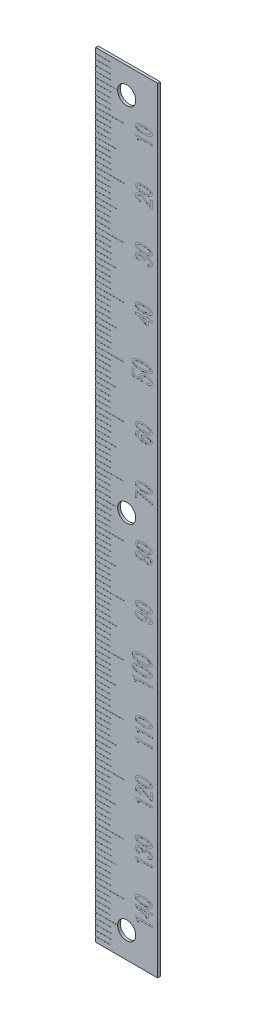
SolidWorks part; units mm, degrees
ref_plane "Front" through (0, 0, 0) normal (0, 0, 1) x (1, 0, 0)
ref_plane "Top" through (0, 0, 0) normal (0, 1, 0) x (1, 0, 0)
ref_plane "Right" through (0, 0, 0) normal (1, 0, 0) x (0, 0, -1)
sketch "Sketch1" plane through (0, 0, 0) normal (0, 0, 1) x (1, 0, 0)
  line L1 (0, 0) -> (0, 150)
  line L2 (0, 0) -> (12, 0)
  line L3 (12, 0) -> (12, 150)
  line L4 (0, 150) -> (12, 150)
  dimension "D1" = 150
  dimension "D2" = 12
extrude "Extrude1" add sketch "Sketch1" along normal blind 0.5
sketch "Sketch2" plane through (0, 0, 0.5) normal (0, 0, 1) x (1, 0, 0)
  line L0 (0, 150) -> (0, 0) construction
  line L1 (0, 0) -> (12, 0) construction
  line L2 (12, 150) -> (0, 150) construction
  circle A0 centre (6, 5) radius 1.75
  circle A1 centre (6, 145) radius 1.75
  circle A4 centre (6, 75) radius 1.75
  dimension "D1" = 6
  dimension "D2" = 6
  dimension "D3" = 5
  dimension "D4" = 5
  dimension "D5" = 3.5
  dimension "D6" = 3.5
  dimension "D8" = 2
extrude "Extrude2" cut sketch "Sketch2" against normal through all
sketch "Sketch3" plane through (0, 0, 0.5) normal (0, 0, 1) x (1, 0, 0)
  line L0 (12, 150) -> (0, 150) construction
  line L1 (7.5, 138.25) -> (11, 138.25) construction
  line L2 (7.5, 138.25) -> (7.5, 141.75) construction
  line L3 (7.5, 141.75) -> (11, 141.75) construction
  line L4 (11, 138.25) -> (11, 141.75) construction
  line L6 (11, 128.25) -> (11, 131.75) construction
  line L7 (11, 118.25) -> (11, 121.75) construction
  line L8 (11, 108.25) -> (11, 111.75) construction
  line L9 (11, 98.25) -> (11, 101.75) construction
  line L10 (11, 88.25) -> (11, 91.75) construction
  line L11 (11, 78.25) -> (11, 81.75) construction
  line L12 (11, 68.25) -> (11, 71.75) construction
  line L13 (11, 58.25) -> (11, 61.75) construction
  line L14 (11, 47.2) -> (11, 52.8) construction
  line L15 (11, 37.2) -> (11, 42.8) construction
  line L16 (11, 48.25) -> (11, 51.75) construction
  line L17 (11, 50) -> (-4.9003, 50) construction
  line L18 (11, 27.2) -> (11, 32.8) construction
  line L19 (11, 17.2) -> (11, 22.8) construction
  line L20 (11, 7.2) -> (11, 12.8) construction
  line L21 (12, 0) -> (12, 150) construction
  text T0 "10" font "ＭＳ ゴシック" height in points 11
  text T1 "20" font "ＭＳ ゴシック" height in points 11
  text T2 "30" font "ＭＳ ゴシック" height in points 11
  text T3 "40" font "ＭＳ ゴシック" height in points 11
  text T4 "50" font "ＭＳ ゴシック" height in points 13
  text T5 "60  " font "ＭＳ ゴシック" height in points 11
  text T6 "70" font "ＭＳ ゴシック" height in points 11
  text T7 "80" font "ＭＳ ゴシック" height in points 11
  text T8 "90" font "ＭＳ ゴシック" height in points 11
  text T9 "100" font "ＭＳ ゴシック" height in points 13
  text T10 "110" font "ＭＳ ゴシック" height in points 11
  text T11 "120" font "ＭＳ ゴシック" height in points 11
  text T12 "130" font "ＭＳ ゴシック" height in points 11
  text T13 "140" font "ＭＳ ゴシック" height in points 11
  point P4 (11, 140)
  dimension "D1" = 3.5
  dimension "D2" = 10
  dimension "D3" = 1
  dimension "D4" = 3.5
  dimension "D8" = 5.6
  dimension "D9" = 1
  dimension "D5" = 4
  dimension "D6" = 7
  dimension "D7" = 5
extrude "Extrude3" cut sketch "Sketch3" against normal blind 0.01
sketch "Sketch4" plane through (0, 0, 0.5) normal (0, 0, 1) x (1, 0, 0)
  line L608 (3, 1.05) -> (3, 0.95)
  line L609 (0, 0.95) -> (3, 0.95)
  line L610 (0, 1.05) -> (3, 1.05)
  line L611 (0, 1.05) -> (0, 0.95)
  line L612 (3, 2.05) -> (3, 1.95)
  line L613 (0, 1.95) -> (3, 1.95)
  line L614 (0, 2.05) -> (3, 2.05)
  line L615 (0, 2.05) -> (0, 1.95)
  line L616 (3, 3.05) -> (3, 2.95)
  line L617 (0, 2.95) -> (3, 2.95)
  line L618 (0, 3.05) -> (3, 3.05)
  line L619 (0, 3.05) -> (0, 2.95)
  line L620 (3, 4.05) -> (3, 3.95)
  line L621 (0, 3.95) -> (3, 3.95)
  line L622 (0, 4.05) -> (3, 4.05)
  line L623 (0, 4.05) -> (0, 3.95)
  line L624 (3, 6.05) -> (3, 5.95)
  line L625 (0, 5.95) -> (3, 5.95)
  line L626 (0, 6.05) -> (3, 6.05)
  line L627 (0, 6.05) -> (0, 5.95)
  line L628 (3, 7.05) -> (3, 6.95)
  line L629 (0, 6.95) -> (3, 6.95)
  line L630 (0, 7.05) -> (3, 7.05)
  line L631 (0, 7.05) -> (0, 6.95)
  line L632 (3, 8.05) -> (3, 7.95)
  line L633 (0, 7.95) -> (3, 7.95)
  line L634 (0, 8.05) -> (3, 8.05)
  line L635 (3, 9.05) -> (3, 8.95)
  line L636 (0, 8.95) -> (3, 8.95)
  line L637 (0, 9.05) -> (0, 8.95)
  line L638 (0, 9.05) -> (3, 9.05)
  line L639 (4, 4.95) -> (4, 5.05)
  line L640 (0, 5.05) -> (4, 5.05)
  line L641 (0, 4.95) -> (0, 5.05)
  line L642 (0, 4.95) -> (4, 4.95)
  line L643 (0, 8.05) -> (0, 7.95)
  line L644 (0, 9.95) -> (0, 10.05)
  line L645 (5.5, 9.95) -> (0, 9.95)
  line L646 (5.5, 10.05) -> (5.5, 9.95)
  line L647 (0, 10.05) -> (5.5, 10.05)
  line L648 (3, 11.05) -> (3, 10.95)
  line L649 (0, 10.95) -> (3, 10.95)
  line L650 (0, 11.05) -> (3, 11.05)
  line L651 (0, 11.05) -> (0, 10.95)
  line L652 (3, 12.05) -> (3, 11.95)
  line L653 (0, 11.95) -> (3, 11.95)
  line L654 (0, 12.05) -> (3, 12.05)
  line L655 (0, 12.05) -> (0, 11.95)
  line L656 (3, 13.05) -> (3, 12.95)
  line L657 (0, 12.95) -> (3, 12.95)
  line L658 (0, 13.05) -> (3, 13.05)
  line L659 (0, 13.05) -> (0, 12.95)
  line L660 (3, 14.05) -> (3, 13.95)
  line L661 (0, 13.95) -> (3, 13.95)
  line L662 (0, 14.05) -> (3, 14.05)
  line L663 (0, 14.05) -> (0, 13.95)
  line L664 (3, 16.05) -> (3, 15.95)
  line L665 (0, 15.95) -> (3, 15.95)
  line L666 (0, 16.05) -> (3, 16.05)
  line L667 (0, 16.05) -> (0, 15.95)
  line L668 (3, 17.05) -> (3, 16.95)
  line L669 (0, 16.95) -> (3, 16.95)
  line L670 (0, 17.05) -> (3, 17.05)
  line L671 (0, 17.05) -> (0, 16.95)
  line L672 (3, 18.05) -> (3, 17.95)
  line L673 (0, 17.95) -> (3, 17.95)
  line L674 (0, 18.05) -> (3, 18.05)
  line L675 (3, 19.05) -> (3, 18.95)
  line L676 (0, 18.95) -> (3, 18.95)
  line L677 (0, 19.05) -> (0, 18.95)
  line L678 (0, 19.05) -> (3, 19.05)
  line L679 (4, 14.95) -> (4, 15.05)
  line L680 (0, 15.05) -> (4, 15.05)
  line L681 (0, 14.95) -> (0, 15.05)
  line L682 (0, 14.95) -> (4, 14.95)
  line L683 (0, 18.05) -> (0, 17.95)
  line L684 (0, 19.95) -> (0, 20.05)
  line L685 (5.5, 19.95) -> (0, 19.95)
  line L686 (5.5, 20.05) -> (5.5, 19.95)
  line L687 (0, 20.05) -> (5.5, 20.05)
  line L688 (3, 21.05) -> (3, 20.95)
  line L689 (0, 20.95) -> (3, 20.95)
  line L690 (0, 21.05) -> (3, 21.05)
  line L691 (0, 21.05) -> (0, 20.95)
  line L692 (3, 22.05) -> (3, 21.95)
  line L693 (0, 21.95) -> (3, 21.95)
  line L694 (0, 22.05) -> (3, 22.05)
  line L695 (0, 22.05) -> (0, 21.95)
  line L696 (3, 23.05) -> (3, 22.95)
  line L697 (0, 22.95) -> (3, 22.95)
  line L698 (0, 23.05) -> (3, 23.05)
  line L699 (0, 23.05) -> (0, 22.95)
  line L700 (3, 24.05) -> (3, 23.95)
  line L701 (0, 23.95) -> (3, 23.95)
  line L702 (0, 24.05) -> (3, 24.05)
  line L703 (0, 24.05) -> (0, 23.95)
  line L704 (3, 26.05) -> (3, 25.95)
  line L705 (0, 25.95) -> (3, 25.95)
  line L706 (0, 26.05) -> (3, 26.05)
  line L707 (0, 26.05) -> (0, 25.95)
  line L708 (3, 27.05) -> (3, 26.95)
  line L709 (0, 26.95) -> (3, 26.95)
  line L710 (0, 27.05) -> (3, 27.05)
  line L711 (0, 27.05) -> (0, 26.95)
  line L712 (3, 28.05) -> (3, 27.95)
  line L713 (0, 27.95) -> (3, 27.95)
  line L714 (0, 28.05) -> (3, 28.05)
  line L715 (3, 29.05) -> (3, 28.95)
  line L716 (0, 28.95) -> (3, 28.95)
  line L717 (0, 29.05) -> (0, 28.95)
  line L718 (0, 29.05) -> (3, 29.05)
  line L719 (4, 24.95) -> (4, 25.05)
  line L720 (0, 25.05) -> (4, 25.05)
  line L721 (0, 24.95) -> (0, 25.05)
  line L722 (0, 24.95) -> (4, 24.95)
  line L723 (0, 28.05) -> (0, 27.95)
  line L724 (0, 29.95) -> (0, 30.05)
  line L725 (5.5, 29.95) -> (0, 29.95)
  line L726 (5.5, 30.05) -> (5.5, 29.95)
  line L727 (0, 30.05) -> (5.5, 30.05)
  line L728 (3, 31.05) -> (3, 30.95)
  line L729 (0, 30.95) -> (3, 30.95)
  line L730 (0, 31.05) -> (3, 31.05)
  line L731 (0, 31.05) -> (0, 30.95)
  line L732 (3, 32.05) -> (3, 31.95)
  line L733 (0, 31.95) -> (3, 31.95)
  line L734 (0, 32.05) -> (3, 32.05)
  line L735 (0, 32.05) -> (0, 31.95)
  line L736 (3, 33.05) -> (3, 32.95)
  line L737 (0, 32.95) -> (3, 32.95)
  line L738 (0, 33.05) -> (3, 33.05)
  line L739 (0, 33.05) -> (0, 32.95)
  line L740 (3, 34.05) -> (3, 33.95)
  line L741 (0, 33.95) -> (3, 33.95)
  line L742 (0, 34.05) -> (3, 34.05)
  line L743 (0, 34.05) -> (0, 33.95)
  line L744 (3, 36.05) -> (3, 35.95)
  line L745 (0, 35.95) -> (3, 35.95)
  line L746 (0, 36.05) -> (3, 36.05)
  line L747 (0, 36.05) -> (0, 35.95)
  line L748 (3, 37.05) -> (3, 36.95)
  line L749 (0, 36.95) -> (3, 36.95)
  line L750 (0, 37.05) -> (3, 37.05)
  line L751 (0, 37.05) -> (0, 36.95)
  line L752 (3, 38.05) -> (3, 37.95)
  line L753 (0, 37.95) -> (3, 37.95)
  line L754 (0, 38.05) -> (3, 38.05)
  line L755 (3, 39.05) -> (3, 38.95)
  line L756 (0, 38.95) -> (3, 38.95)
  line L757 (0, 39.05) -> (0, 38.95)
  line L758 (0, 39.05) -> (3, 39.05)
  line L759 (4, 34.95) -> (4, 35.05)
  line L760 (0, 35.05) -> (4, 35.05)
  line L761 (0, 34.95) -> (0, 35.05)
  line L762 (0, 34.95) -> (4, 34.95)
  line L763 (0, 38.05) -> (0, 37.95)
  line L764 (0, 39.95) -> (0, 40.05)
  line L765 (5.5, 39.95) -> (0, 39.95)
  line L766 (5.5, 40.05) -> (5.5, 39.95)
  line L767 (0, 40.05) -> (5.5, 40.05)
  line L768 (3, 41.05) -> (3, 40.95)
  line L769 (0, 40.95) -> (3, 40.95)
  line L770 (0, 41.05) -> (3, 41.05)
  line L771 (0, 41.05) -> (0, 40.95)
  line L772 (3, 42.05) -> (3, 41.95)
  line L773 (0, 41.95) -> (3, 41.95)
  line L774 (0, 42.05) -> (3, 42.05)
  line L775 (0, 42.05) -> (0, 41.95)
  line L776 (3, 43.05) -> (3, 42.95)
  line L777 (0, 42.95) -> (3, 42.95)
  line L778 (0, 43.05) -> (3, 43.05)
  line L779 (0, 43.05) -> (0, 42.95)
  line L780 (3, 44.05) -> (3, 43.95)
  line L781 (0, 43.95) -> (3, 43.95)
  line L782 (0, 44.05) -> (3, 44.05)
  line L783 (0, 44.05) -> (0, 43.95)
  line L784 (3, 46.05) -> (3, 45.95)
  line L785 (0, 45.95) -> (3, 45.95)
  line L786 (0, 46.05) -> (3, 46.05)
  line L787 (0, 46.05) -> (0, 45.95)
  line L788 (3, 47.05) -> (3, 46.95)
  line L789 (0, 46.95) -> (3, 46.95)
  line L790 (0, 47.05) -> (3, 47.05)
  line L791 (0, 47.05) -> (0, 46.95)
  line L792 (3, 48.05) -> (3, 47.95)
  line L793 (0, 47.95) -> (3, 47.95)
  line L794 (0, 48.05) -> (3, 48.05)
  line L795 (3, 49.05) -> (3, 48.95)
  line L796 (0, 48.95) -> (3, 48.95)
  line L797 (0, 49.05) -> (0, 48.95)
  line L798 (0, 49.05) -> (3, 49.05)
  line L799 (4, 44.95) -> (4, 45.05)
  line L800 (0, 45.05) -> (4, 45.05)
  line L801 (0, 44.95) -> (0, 45.05)
  line L802 (0, 44.95) -> (4, 44.95)
  line L803 (0, 48.05) -> (0, 47.95)
  line L804 (0, 49.95) -> (0, 50.05)
  line L805 (5.5, 49.95) -> (0, 49.95)
  line L806 (5.5, 50.05) -> (5.5, 49.95)
  line L807 (0, 50.05) -> (5.5, 50.05)
  line L808 (3, 51.05) -> (3, 50.95)
  line L809 (0, 50.95) -> (3, 50.95)
  line L810 (0, 51.05) -> (3, 51.05)
  line L811 (0, 51.05) -> (0, 50.95)
  line L812 (3, 52.05) -> (3, 51.95)
  line L813 (0, 51.95) -> (3, 51.95)
  line L814 (0, 52.05) -> (3, 52.05)
  line L815 (0, 52.05) -> (0, 51.95)
  line L816 (3, 53.05) -> (3, 52.95)
  line L817 (0, 52.95) -> (3, 52.95)
  line L818 (0, 53.05) -> (3, 53.05)
  line L819 (0, 53.05) -> (0, 52.95)
  line L820 (3, 54.05) -> (3, 53.95)
  line L821 (0, 53.95) -> (3, 53.95)
  line L822 (0, 54.05) -> (3, 54.05)
  line L823 (0, 54.05) -> (0, 53.95)
  line L824 (3, 56.05) -> (3, 55.95)
  line L825 (0, 55.95) -> (3, 55.95)
  line L826 (0, 56.05) -> (3, 56.05)
  line L827 (0, 56.05) -> (0, 55.95)
  line L828 (3, 57.05) -> (3, 56.95)
  line L829 (0, 56.95) -> (3, 56.95)
  line L830 (0, 57.05) -> (3, 57.05)
  line L831 (0, 57.05) -> (0, 56.95)
  line L832 (3, 58.05) -> (3, 57.95)
  line L833 (0, 57.95) -> (3, 57.95)
  line L834 (0, 58.05) -> (3, 58.05)
  line L835 (3, 59.05) -> (3, 58.95)
  line L836 (0, 58.95) -> (3, 58.95)
  line L837 (0, 59.05) -> (0, 58.95)
  line L838 (0, 59.05) -> (3, 59.05)
  line L839 (4, 54.95) -> (4, 55.05)
  line L840 (0, 55.05) -> (4, 55.05)
  line L841 (0, 54.95) -> (0, 55.05)
  line L842 (0, 54.95) -> (4, 54.95)
  line L843 (0, 58.05) -> (0, 57.95)
  line L844 (0, 59.95) -> (0, 60.05)
  line L845 (5.5, 59.95) -> (0, 59.95)
  line L846 (5.5, 60.05) -> (5.5, 59.95)
  line L847 (0, 60.05) -> (5.5, 60.05)
  line L848 (3, 61.05) -> (3, 60.95)
  line L849 (0, 60.95) -> (3, 60.95)
  line L850 (0, 61.05) -> (3, 61.05)
  line L851 (0, 61.05) -> (0, 60.95)
  line L852 (3, 62.05) -> (3, 61.95)
  line L853 (0, 61.95) -> (3, 61.95)
  line L854 (0, 62.05) -> (3, 62.05)
  line L855 (0, 62.05) -> (0, 61.95)
  line L856 (3, 63.05) -> (3, 62.95)
  line L857 (0, 62.95) -> (3, 62.95)
  line L858 (0, 63.05) -> (3, 63.05)
  line L859 (0, 63.05) -> (0, 62.95)
  line L860 (3, 64.05) -> (3, 63.95)
  line L861 (0, 63.95) -> (3, 63.95)
  line L862 (0, 64.05) -> (3, 64.05)
  line L863 (0, 64.05) -> (0, 63.95)
  line L864 (3, 66.05) -> (3, 65.95)
  line L865 (0, 65.95) -> (3, 65.95)
  line L866 (0, 66.05) -> (3, 66.05)
  line L867 (0, 66.05) -> (0, 65.95)
  line L868 (3, 67.05) -> (3, 66.95)
  line L869 (0, 66.95) -> (3, 66.95)
  line L870 (0, 67.05) -> (3, 67.05)
  line L871 (0, 67.05) -> (0, 66.95)
  line L872 (3, 68.05) -> (3, 67.95)
  line L873 (0, 67.95) -> (3, 67.95)
  line L874 (0, 68.05) -> (3, 68.05)
  line L875 (3, 69.05) -> (3, 68.95)
  line L876 (0, 68.95) -> (3, 68.95)
  line L877 (0, 69.05) -> (0, 68.95)
  line L878 (0, 69.05) -> (3, 69.05)
  line L879 (4, 64.95) -> (4, 65.05)
  line L880 (0, 65.05) -> (4, 65.05)
  line L881 (0, 64.95) -> (0, 65.05)
  line L882 (0, 64.95) -> (4, 64.95)
  line L883 (0, 68.05) -> (0, 67.95)
  line L884 (0, 69.95) -> (0, 70.05)
  line L885 (5.5, 69.95) -> (0, 69.95)
  line L886 (5.5, 70.05) -> (5.5, 69.95)
  line L887 (0, 70.05) -> (5.5, 70.05)
  line L888 (3, 71.05) -> (3, 70.95)
  line L889 (0, 70.95) -> (3, 70.95)
  line L890 (0, 71.05) -> (3, 71.05)
  line L891 (0, 71.05) -> (0, 70.95)
  line L892 (3, 72.05) -> (3, 71.95)
  line L893 (0, 71.95) -> (3, 71.95)
  line L894 (0, 72.05) -> (3, 72.05)
  line L895 (0, 72.05) -> (0, 71.95)
  line L896 (3, 73.05) -> (3, 72.95)
  line L897 (0, 72.95) -> (3, 72.95)
  line L898 (0, 73.05) -> (3, 73.05)
  line L899 (0, 73.05) -> (0, 72.95)
  line L900 (3, 74.05) -> (3, 73.95)
  line L901 (0, 73.95) -> (3, 73.95)
  line L902 (0, 74.05) -> (3, 74.05)
  line L903 (0, 74.05) -> (0, 73.95)
  line L904 (3, 76.05) -> (3, 75.95)
  line L905 (0, 75.95) -> (3, 75.95)
  line L906 (0, 76.05) -> (3, 76.05)
  line L907 (0, 76.05) -> (0, 75.95)
  line L908 (3, 77.05) -> (3, 76.95)
  line L909 (0, 76.95) -> (3, 76.95)
  line L910 (0, 77.05) -> (3, 77.05)
  line L911 (0, 77.05) -> (0, 76.95)
  line L912 (3, 78.05) -> (3, 77.95)
  line L913 (0, 77.95) -> (3, 77.95)
  line L914 (0, 78.05) -> (3, 78.05)
  line L915 (3, 79.05) -> (3, 78.95)
  line L916 (0, 78.95) -> (3, 78.95)
  line L917 (0, 79.05) -> (0, 78.95)
  line L918 (0, 79.05) -> (3, 79.05)
  line L919 (4, 74.95) -> (4, 75.05)
  line L920 (0, 75.05) -> (4, 75.05)
  line L921 (0, 74.95) -> (0, 75.05)
  line L922 (0, 74.95) -> (4, 74.95)
  line L923 (0, 78.05) -> (0, 77.95)
  line L924 (0, 79.95) -> (0, 80.05)
  line L925 (5.5, 79.95) -> (0, 79.95)
  line L926 (5.5, 80.05) -> (5.5, 79.95)
  line L927 (0, 80.05) -> (5.5, 80.05)
  line L928 (3, 81.05) -> (3, 80.95)
  line L929 (0, 80.95) -> (3, 80.95)
  line L930 (0, 81.05) -> (3, 81.05)
  line L931 (0, 81.05) -> (0, 80.95)
  line L932 (3, 82.05) -> (3, 81.95)
  line L933 (0, 81.95) -> (3, 81.95)
  line L934 (0, 82.05) -> (3, 82.05)
  line L935 (0, 82.05) -> (0, 81.95)
  line L936 (3, 83.05) -> (3, 82.95)
  line L937 (0, 82.95) -> (3, 82.95)
  line L938 (0, 83.05) -> (3, 83.05)
  line L939 (0, 83.05) -> (0, 82.95)
  line L940 (3, 84.05) -> (3, 83.95)
  line L941 (0, 83.95) -> (3, 83.95)
  line L942 (0, 84.05) -> (3, 84.05)
  line L943 (0, 84.05) -> (0, 83.95)
  line L944 (3, 86.05) -> (3, 85.95)
  line L945 (0, 85.95) -> (3, 85.95)
  line L946 (0, 86.05) -> (3, 86.05)
  line L947 (0, 86.05) -> (0, 85.95)
  line L948 (3, 87.05) -> (3, 86.95)
  line L949 (0, 86.95) -> (3, 86.95)
  line L950 (0, 87.05) -> (3, 87.05)
  line L951 (0, 87.05) -> (0, 86.95)
  line L952 (3, 88.05) -> (3, 87.95)
  line L953 (0, 87.95) -> (3, 87.95)
  line L954 (0, 88.05) -> (3, 88.05)
  line L955 (3, 89.05) -> (3, 88.95)
  line L956 (0, 88.95) -> (3, 88.95)
  line L957 (0, 89.05) -> (0, 88.95)
  line L958 (0, 89.05) -> (3, 89.05)
  line L959 (4, 84.95) -> (4, 85.05)
  line L960 (0, 85.05) -> (4, 85.05)
  line L961 (0, 84.95) -> (0, 85.05)
  line L962 (0, 84.95) -> (4, 84.95)
  line L963 (0, 88.05) -> (0, 87.95)
  line L964 (0, 89.95) -> (0, 90.05)
  line L965 (5.5, 89.95) -> (0, 89.95)
  line L966 (5.5, 90.05) -> (5.5, 89.95)
  line L967 (0, 90.05) -> (5.5, 90.05)
  line L968 (3, 91.05) -> (3, 90.95)
  line L969 (0, 90.95) -> (3, 90.95)
  line L970 (0, 91.05) -> (3, 91.05)
  line L971 (0, 91.05) -> (0, 90.95)
  line L972 (3, 92.05) -> (3, 91.95)
  line L973 (0, 91.95) -> (3, 91.95)
  line L974 (0, 92.05) -> (3, 92.05)
  line L975 (0, 92.05) -> (0, 91.95)
  line L976 (3, 93.05) -> (3, 92.95)
  line L977 (0, 92.95) -> (3, 92.95)
  line L978 (0, 93.05) -> (3, 93.05)
  line L979 (0, 93.05) -> (0, 92.95)
  line L980 (3, 94.05) -> (3, 93.95)
  line L981 (0, 93.95) -> (3, 93.95)
  line L982 (0, 94.05) -> (3, 94.05)
  line L983 (0, 94.05) -> (0, 93.95)
  line L984 (3, 96.05) -> (3, 95.95)
  line L985 (0, 95.95) -> (3, 95.95)
  line L986 (0, 96.05) -> (3, 96.05)
  line L987 (0, 96.05) -> (0, 95.95)
  line L988 (3, 97.05) -> (3, 96.95)
  line L989 (0, 96.95) -> (3, 96.95)
  line L990 (0, 97.05) -> (3, 97.05)
  line L991 (0, 97.05) -> (0, 96.95)
  line L992 (3, 98.05) -> (3, 97.95)
  line L993 (0, 97.95) -> (3, 97.95)
  line L994 (0, 98.05) -> (3, 98.05)
  line L995 (3, 99.05) -> (3, 98.95)
  line L996 (0, 98.95) -> (3, 98.95)
  line L997 (0, 99.05) -> (0, 98.95)
  line L998 (0, 99.05) -> (3, 99.05)
  line L999 (4, 94.95) -> (4, 95.05)
  line L1000 (0, 95.05) -> (4, 95.05)
  line L1001 (0, 94.95) -> (0, 95.05)
  line L1002 (0, 94.95) -> (4, 94.95)
  line L1003 (0, 98.05) -> (0, 97.95)
  line L1004 (3, 101.05) -> (3, 100.95)
  line L1005 (0, 100.95) -> (3, 100.95)
  line L1006 (0, 101.05) -> (3, 101.05)
  line L1007 (0, 101.05) -> (0, 100.95)
  line L1008 (3, 102.05) -> (3, 101.95)
  line L1009 (0, 101.95) -> (3, 101.95)
  line L1010 (0, 102.05) -> (3, 102.05)
  line L1011 (0, 102.05) -> (0, 101.95)
  line L1012 (3, 103.05) -> (3, 102.95)
  line L1013 (0, 102.95) -> (3, 102.95)
  line L1014 (0, 103.05) -> (3, 103.05)
  line L1015 (0, 103.05) -> (0, 102.95)
  line L1016 (3, 104.05) -> (3, 103.95)
  line L1017 (0, 103.95) -> (3, 103.95)
  line L1018 (0, 104.05) -> (3, 104.05)
  line L1019 (0, 104.05) -> (0, 103.95)
  line L1020 (3, 106.05) -> (3, 105.95)
  line L1021 (0, 105.95) -> (3, 105.95)
  line L1022 (0, 106.05) -> (3, 106.05)
  line L1023 (0, 106.05) -> (0, 105.95)
  line L1024 (3, 107.05) -> (3, 106.95)
  line L1025 (0, 106.95) -> (3, 106.95)
  line L1026 (0, 107.05) -> (3, 107.05)
  line L1027 (0, 107.05) -> (0, 106.95)
  line L1028 (3, 108.05) -> (3, 107.95)
  line L1029 (0, 107.95) -> (3, 107.95)
  line L1030 (0, 108.05) -> (3, 108.05)
  line L1031 (3, 109.05) -> (3, 108.95)
  line L1032 (0, 108.95) -> (3, 108.95)
  line L1033 (0, 109.05) -> (0, 108.95)
  line L1034 (0, 109.05) -> (3, 109.05)
  line L1035 (4, 104.95) -> (4, 105.05)
  line L1036 (0, 105.05) -> (4, 105.05)
  line L1037 (0, 104.95) -> (0, 105.05)
  line L1038 (0, 104.95) -> (4, 104.95)
  line L1039 (0, 108.05) -> (0, 107.95)
  line L1040 (0, 99.95) -> (0, 100.05)
  line L1041 (5.5, 99.95) -> (0, 99.95)
  line L1042 (5.5, 100.05) -> (5.5, 99.95)
  line L1043 (0, 100.05) -> (5.5, 100.05)
  line L1044 (3, 111.05) -> (3, 110.95)
  line L1045 (0, 110.95) -> (3, 110.95)
  line L1046 (0, 111.05) -> (3, 111.05)
  line L1047 (0, 111.05) -> (0, 110.95)
  line L1048 (3, 112.05) -> (3, 111.95)
  line L1049 (0, 111.95) -> (3, 111.95)
  line L1050 (0, 112.05) -> (3, 112.05)
  line L1051 (0, 112.05) -> (0, 111.95)
  line L1052 (3, 113.05) -> (3, 112.95)
  line L1053 (0, 112.95) -> (3, 112.95)
  line L1054 (0, 113.05) -> (3, 113.05)
  line L1055 (0, 113.05) -> (0, 112.95)
  line L1056 (3, 114.05) -> (3, 113.95)
  line L1057 (0, 113.95) -> (3, 113.95)
  line L1058 (0, 114.05) -> (3, 114.05)
  line L1059 (0, 114.05) -> (0, 113.95)
  line L1060 (3, 116.05) -> (3, 115.95)
  line L1061 (0, 115.95) -> (3, 115.95)
  line L1062 (0, 116.05) -> (3, 116.05)
  line L1063 (0, 116.05) -> (0, 115.95)
  line L1064 (3, 117.05) -> (3, 116.95)
  line L1065 (0, 116.95) -> (3, 116.95)
  line L1066 (0, 117.05) -> (3, 117.05)
  line L1067 (0, 117.05) -> (0, 116.95)
  line L1068 (3, 118.05) -> (3, 117.95)
  line L1069 (0, 117.95) -> (3, 117.95)
  line L1070 (0, 118.05) -> (3, 118.05)
  line L1071 (3, 119.05) -> (3, 118.95)
  line L1072 (0, 118.95) -> (3, 118.95)
  line L1073 (0, 119.05) -> (0, 118.95)
  line L1074 (0, 119.05) -> (3, 119.05)
  line L1075 (4, 114.95) -> (4, 115.05)
  line L1076 (0, 115.05) -> (4, 115.05)
  line L1077 (0, 114.95) -> (0, 115.05)
  line L1078 (0, 114.95) -> (4, 114.95)
  line L1079 (0, 118.05) -> (0, 117.95)
  line L1080 (0, 109.95) -> (0, 110.05)
  line L1081 (5.5, 109.95) -> (0, 109.95)
  line L1082 (5.5, 110.05) -> (5.5, 109.95)
  line L1083 (0, 110.05) -> (5.5, 110.05)
  line L1084 (3, 121.05) -> (3, 120.95)
  line L1085 (0, 120.95) -> (3, 120.95)
  line L1086 (0, 121.05) -> (3, 121.05)
  line L1087 (0, 121.05) -> (0, 120.95)
  line L1088 (3, 122.05) -> (3, 121.95)
  line L1089 (0, 121.95) -> (3, 121.95)
  line L1090 (0, 122.05) -> (3, 122.05)
  line L1091 (0, 122.05) -> (0, 121.95)
  line L1092 (3, 123.05) -> (3, 122.95)
  line L1093 (0, 122.95) -> (3, 122.95)
  line L1094 (0, 123.05) -> (3, 123.05)
  line L1095 (0, 123.05) -> (0, 122.95)
  line L1096 (3, 124.05) -> (3, 123.95)
  line L1097 (0, 123.95) -> (3, 123.95)
  line L1098 (0, 124.05) -> (3, 124.05)
  line L1099 (0, 124.05) -> (0, 123.95)
  line L1100 (3, 126.05) -> (3, 125.95)
  line L1101 (0, 125.95) -> (3, 125.95)
  line L1102 (0, 126.05) -> (3, 126.05)
  line L1103 (0, 126.05) -> (0, 125.95)
  line L1104 (3, 127.05) -> (3, 126.95)
  line L1105 (0, 126.95) -> (3, 126.95)
  line L1106 (0, 127.05) -> (3, 127.05)
  line L1107 (0, 127.05) -> (0, 126.95)
  line L1108 (3, 128.05) -> (3, 127.95)
  line L1109 (0, 127.95) -> (3, 127.95)
  line L1110 (0, 128.05) -> (3, 128.05)
  line L1111 (3, 129.05) -> (3, 128.95)
  line L1112 (0, 128.95) -> (3, 128.95)
  line L1113 (0, 129.05) -> (0, 128.95)
  line L1114 (0, 129.05) -> (3, 129.05)
  line L1115 (4, 124.95) -> (4, 125.05)
  line L1116 (0, 125.05) -> (4, 125.05)
  line L1117 (0, 124.95) -> (0, 125.05)
  line L1118 (0, 124.95) -> (4, 124.95)
  line L1119 (0, 128.05) -> (0, 127.95)
  line L1120 (0, 119.95) -> (0, 120.05)
  line L1121 (5.5, 119.95) -> (0, 119.95)
  line L1122 (5.5, 120.05) -> (5.5, 119.95)
  line L1123 (0, 120.05) -> (5.5, 120.05)
  line L1124 (3, 131.05) -> (3, 130.95)
  line L1125 (0, 130.95) -> (3, 130.95)
  line L1126 (0, 131.05) -> (3, 131.05)
  line L1127 (0, 131.05) -> (0, 130.95)
  line L1128 (3, 132.05) -> (3, 131.95)
  line L1129 (0, 131.95) -> (3, 131.95)
  line L1130 (0, 132.05) -> (3, 132.05)
  line L1131 (0, 132.05) -> (0, 131.95)
  line L1132 (3, 133.05) -> (3, 132.95)
  line L1133 (0, 132.95) -> (3, 132.95)
  line L1134 (0, 133.05) -> (3, 133.05)
  line L1135 (0, 133.05) -> (0, 132.95)
  line L1136 (3, 134.05) -> (3, 133.95)
  line L1137 (0, 133.95) -> (3, 133.95)
  line L1138 (0, 134.05) -> (3, 134.05)
  line L1139 (0, 134.05) -> (0, 133.95)
  line L1140 (3, 136.05) -> (3, 135.95)
  line L1141 (0, 135.95) -> (3, 135.95)
  line L1142 (0, 136.05) -> (3, 136.05)
  line L1143 (0, 136.05) -> (0, 135.95)
  line L1144 (3, 137.05) -> (3, 136.95)
  line L1145 (0, 136.95) -> (3, 136.95)
  line L1146 (0, 137.05) -> (3, 137.05)
  line L1147 (0, 137.05) -> (0, 136.95)
  line L1148 (3, 138.05) -> (3, 137.95)
  line L1149 (0, 137.95) -> (3, 137.95)
  line L1150 (0, 138.05) -> (3, 138.05)
  line L1151 (3, 139.05) -> (3, 138.95)
  line L1152 (0, 138.95) -> (3, 138.95)
  line L1153 (0, 139.05) -> (0, 138.95)
  line L1154 (0, 139.05) -> (3, 139.05)
  line L1155 (4, 134.95) -> (4, 135.05)
  line L1156 (0, 135.05) -> (4, 135.05)
  line L1157 (0, 134.95) -> (0, 135.05)
  line L1158 (0, 134.95) -> (4, 134.95)
  line L1159 (0, 138.05) -> (0, 137.95)
  line L1160 (3, 141.05) -> (3, 140.95)
  line L1161 (0, 140.95) -> (3, 140.95)
  line L1162 (0, 141.05) -> (3, 141.05)
  line L1163 (0, 141.05) -> (0, 140.95)
  line L1164 (3, 142.05) -> (3, 141.95)
  line L1165 (0, 141.95) -> (3, 141.95)
  line L1166 (0, 142.05) -> (3, 142.05)
  line L1167 (0, 142.05) -> (0, 141.95)
  line L1168 (3, 143.05) -> (3, 142.95)
  line L1169 (0, 142.95) -> (3, 142.95)
  line L1170 (0, 143.05) -> (3, 143.05)
  line L1171 (0, 143.05) -> (0, 142.95)
  line L1172 (3, 144.05) -> (3, 143.95)
  line L1173 (0, 143.95) -> (3, 143.95)
  line L1174 (0, 144.05) -> (3, 144.05)
  line L1175 (0, 144.05) -> (0, 143.95)
  line L1176 (0, 129.95) -> (0, 130.05)
  line L1177 (5.5, 129.95) -> (0, 129.95)
  line L1178 (5.5, 130.05) -> (5.5, 129.95)
  line L1179 (0, 130.05) -> (5.5, 130.05)
  line L1180 (3, 146.05) -> (3, 145.95)
  line L1181 (0, 145.95) -> (3, 145.95)
  line L1182 (0, 146.05) -> (3, 146.05)
  line L1183 (0, 146.05) -> (0, 145.95)
  line L1184 (3, 147.05) -> (3, 146.95)
  line L1185 (0, 146.95) -> (3, 146.95)
  line L1186 (0, 147.05) -> (3, 147.05)
  line L1187 (0, 147.05) -> (0, 146.95)
  line L1188 (3, 148.05) -> (3, 147.95)
  line L1189 (0, 147.95) -> (3, 147.95)
  line L1190 (0, 148.05) -> (3, 148.05)
  line L1191 (3, 149.05) -> (3, 148.95)
  line L1192 (0, 148.95) -> (3, 148.95)
  line L1193 (0, 149.05) -> (0, 148.95)
  line L1194 (0, 149.05) -> (3, 149.05)
  line L1195 (4, 144.95) -> (4, 145.05)
  line L1196 (0, 145.05) -> (4, 145.05)
  line L1197 (0, 144.95) -> (0, 145.05)
  line L1198 (0, 144.95) -> (4, 144.95)
  line L1199 (0, 148.05) -> (0, 147.95)
  line L1200 (0, 139.95) -> (0, 140.05)
  line L1201 (5.5, 139.95) -> (0, 139.95)
  line L1202 (5.5, 140.05) -> (5.5, 139.95)
  line L1203 (0, 140.05) -> (5.5, 140.05)
extrude "Extrude4" cut sketch "Sketch4" against normal blind 0.01
move or copy body "Body-Move/Copy2" bodies to move or copy 105 copy no translate (-12, -150, 0)
